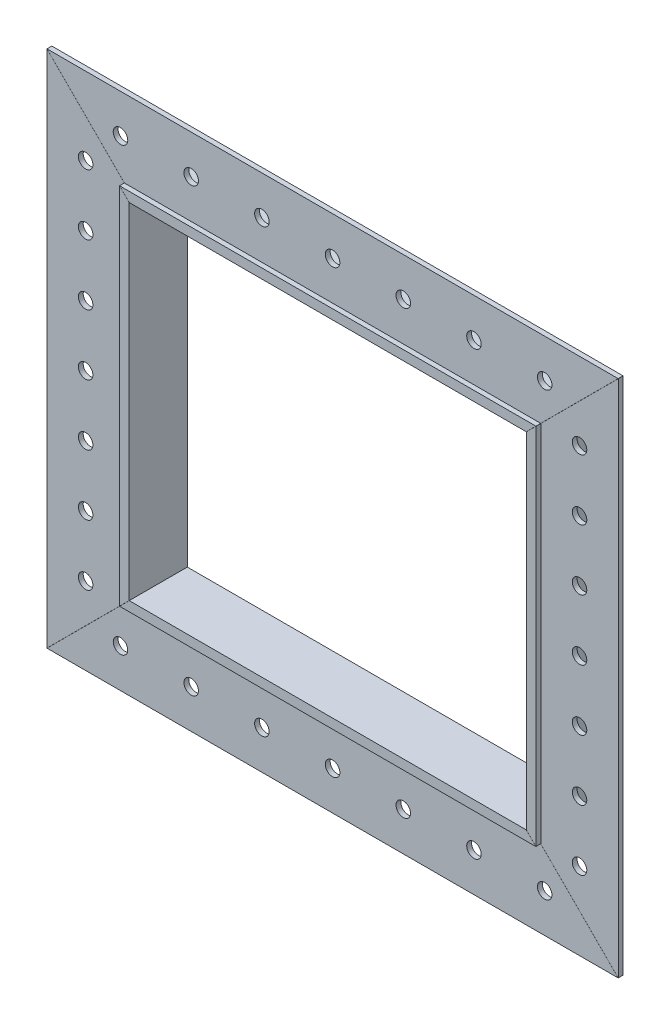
SolidWorks part; units mm, degrees
ref_plane "Front Plane" through (0, 0, 0) normal (0, 0, 1) x (1, 0, 0)
ref_plane "Top Plane" through (0, 0, 0) normal (0, 1, 0) x (1, 0, 0)
ref_plane "Right Plane" through (0, 0, 0) normal (1, 0, 0) x (0, 0, -1)
sketch "Sketch1" plane through (0, 0, 0) normal (0, 0, 1) x (1, 0, 0)
  line L1 (-68.2625, 59.69) -> (68.2625, 59.69)
  line L2 (-68.2625, 59.69) -> (-68.2625, -59.69)
  line L3 (-68.2625, -59.69) -> (68.2625, -59.69)
  line L4 (68.2625, 59.69) -> (68.2625, -59.69)
  line L5 (-68.2625, 59.69) -> (68.2625, -59.69) construction
  line L6 (-68.2625, -59.69) -> (68.2625, 59.69) construction
  line L7 (-65.0875, 56.515) -> (65.0875, 56.515)
  line L8 (-65.0875, 56.515) -> (-65.0875, -56.515)
  line L9 (-65.0875, -56.515) -> (65.0875, -56.515)
  line L10 (65.0875, 56.515) -> (65.0875, -56.515)
  line L11 (-65.0875, 56.515) -> (65.0875, -56.515) construction
  line L12 (-65.0875, -56.515) -> (65.0875, 56.515) construction
  point P0 (0, 0)
  point P6 (0, 0)
  dimension "D1" = 3.175
  dimension "D2" = 3.175
  dimension "D3" = 130.175
  dimension "D4" = 119.38
extrude "Boss-Extrude1" add sketch "Sketch1" along normal mid plane 19.05
ref_plane "Plane1" through (0, 0, 7.9375) normal (0, 0, 1) x (1, 0, 0)
sketch "Sketch2" plane through (0, 0, 7.9375) normal (0, 0, 1) x (1, 0, 0)
  line L1 (-93.6625, 85.09) -> (93.6625, 85.09)
  line L2 (-93.6625, 85.09) -> (-93.6625, -85.09)
  line L3 (-93.6625, -85.09) -> (93.6625, -85.09)
  line L4 (68.2625, -59.69) -> (68.2625, 59.69)
  line L5 (68.2625, 59.69) -> (-68.2625, 59.69)
  line L6 (-68.2625, 59.69) -> (-68.2625, -59.69)
  line L7 (-68.2625, -59.69) -> (68.2625, -59.69)
  line L8 (68.2625, -59.69) -> (68.2625, 59.69)
  line L9 (68.2625, 59.69) -> (-68.2625, 59.69)
  line L10 (-68.2625, 59.69) -> (-68.2625, -59.69)
  line L11 (-68.2625, -59.69) -> (68.2625, -59.69)
  line L12 (93.6625, 85.09) -> (93.6625, -85.09)
  line L13 (-93.6625, 85.09) -> (93.6625, -85.09) construction
  line L14 (-93.6625, -85.09) -> (93.6625, 85.09) construction
  line L15 (-68.2625, 59.69) -> (68.2625, -59.69) construction
  point P2 (0, 0)
  point P12 (0, 0)
  dimension "D2" = 25.4
  dimension "D3" = 25.4
  dimension "D1" = 0
extrude "Boss-Extrude2" add sketch "Sketch2" against normal blind 1.5875
sketch "Sketch3" plane through (0, 0, 7.9375) normal (0, 0, 1) x (1, 0, 0)
  line L0 (-93.6625, 85.09) -> (-68.2625, 59.69)
  line L1 (-68.2625, 59.69) -> (-65.0875, 56.515)
  line L2 (-93.6625, -85.09) -> (-68.2625, -59.69)
  line L3 (-68.2625, -59.69) -> (-65.0875, -56.515)
  line L4 (65.0875, 56.515) -> (68.2625, 59.69)
  line L5 (68.2625, 59.69) -> (93.6625, 85.09)
  line L6 (65.0875, -56.515) -> (68.2625, -59.69)
  line L7 (68.2625, -59.69) -> (93.6625, -85.09)
extrude "Cut-Extrude-Thin1" cut sketch "Sketch3" against normal through all both and the other way through all thin
sketch "Sketch5" plane through (0, 0, 7.9375) normal (0, 0, 1) x (1, 0, 0)
  line L0 (-93.6625, 85.072) -> (-93.6625, -85.072) construction
  line L1 (80.9625, -72.39) -> (-80.9625, -72.39) construction
  line L2 (80.9625, -72.39) -> (80.9625, 72.39) construction
  line L3 (80.9625, 72.39) -> (-80.9625, 72.39) construction
  line L4 (-80.9625, -72.39) -> (-80.9625, 72.39) construction
  line L5 (80.9625, -72.39) -> (-80.9625, 72.39) construction
  line L6 (80.9625, 72.39) -> (-80.9625, -72.39) construction
  line L7 (93.6445, 85.09) -> (-93.6445, 85.09) construction
  line L8 (93.6625, -85.072) -> (93.6625, 85.072) construction
  line L9 (-93.6445, -85.09) -> (93.6445, -85.09) construction
  line L10 (0, 0) -> (44.1142, 0) construction
  line L11 (0, 0) -> (0, 39.8747) construction
  circle A3 centre (-69.5325, 72.39) radius 2.3813
  circle A4 centre (-48.4505, 72.39) radius 2.3812 construction
  circle A5 centre (-46.355, 72.39) radius 2.3812
  circle A6 centre (-23.1775, 72.39) radius 2.3812
  circle A7 centre (0, 72.39) radius 2.3812
  circle A8 centre (23.1775, 72.39) radius 2.3812
  circle A9 centre (46.355, 72.39) radius 2.3812
  circle A10 centre (69.5325, 72.39) radius 2.3813
  circle A11 centre (80.9625, 59.69) radius 2.3813
  circle A12 centre (80.9625, 39.7933) radius 2.3813
  circle A13 centre (80.9625, 19.8967) radius 2.3813
  circle A14 centre (80.9625, 0) radius 2.3813
  circle A15 centre (80.9625, -19.8967) radius 2.3813
  circle A16 centre (80.9625, -39.7933) radius 2.3813
  circle A17 centre (80.9625, -59.69) radius 2.3813
  circle A18 centre (-80.9625, -59.69) radius 2.3813
  circle A19 centre (-80.9625, -39.7933) radius 2.3813
  circle A20 centre (-80.9625, -19.8967) radius 2.3813
  circle A21 centre (-80.9625, 0) radius 2.3813
  circle A22 centre (-80.9625, 19.8967) radius 2.3813
  circle A23 centre (-80.9625, 39.7933) radius 2.3813
  circle A24 centre (-80.9625, 59.69) radius 2.3813
  circle A25 centre (-48.4505, -72.39) radius 2.3812 construction
  circle A26 centre (69.5325, -72.39) radius 2.3812
  circle A27 centre (46.355, -72.39) radius 2.3812
  circle A28 centre (23.1775, -72.39) radius 2.3812
  circle A29 centre (0, -72.39) radius 2.3812
  circle A30 centre (-23.1775, -72.39) radius 2.3812
  circle A31 centre (-46.355, -72.39) radius 2.3812
  circle A32 centre (-69.5325, -72.39) radius 2.3813
  point P0 (0, 0)
  dimension "D5" = 21.082
  dimension "D7" = 4.7625
  dimension "D9" = 11.43
  dimension "D12" = 12.7
  dimension "D1" = 12.7
  dimension "D2" = 12.7
  dimension "D3" = 12.7
  dimension "D4" = 12.7
  dimension "D6" = 11.43
  dimension "D10" = 12.7
  dimension "D8" = 7
  dimension "D11" = 7
extrude "Cut-Extrude1" cut sketch "Sketch5" against normal up to surface (1.5875 mm away)
